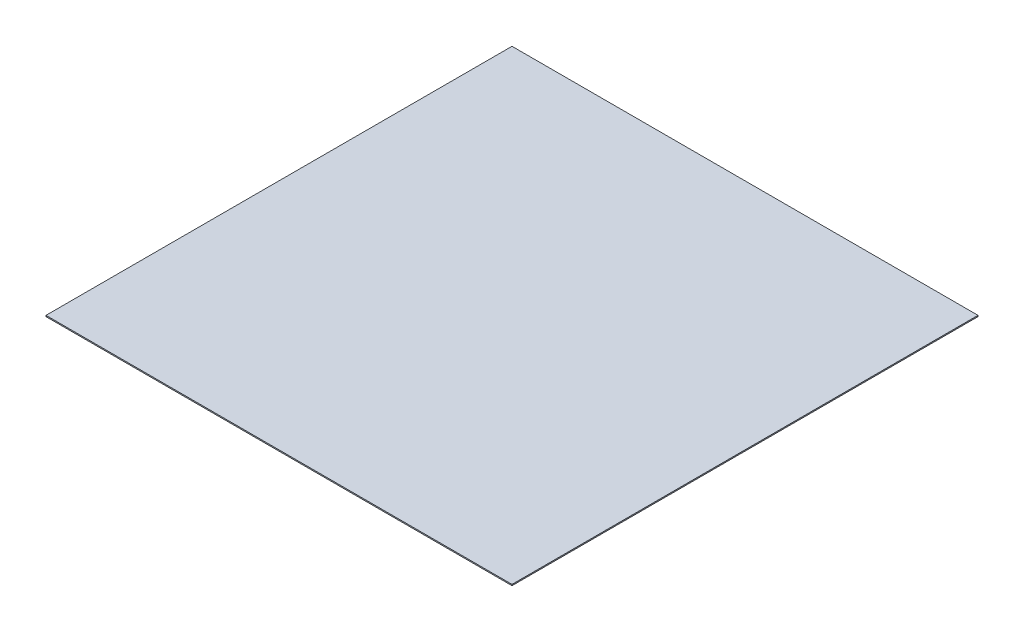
SolidWorks part; units mm, degrees
ref_plane "Plan de face" through (0, 0, 0) normal (0, 0, 1) x (1, 0, 0)
ref_plane "Plan de dessus" through (0, 0, 0) normal (0, 1, 0) x (1, 0, 0)
ref_plane "Plan de droite" through (0, 0, 0) normal (1, 0, 0) x (0, 0, -1)
sketch "Esquisse1" plane through (0, 0, 0) normal (0, 0, 1) x (1, 0, 0)
  line L0 (-1000, 0) -> (1000, 0)
  dimension "D1" = 2000
extrude "Extru.-Mince1" add sketch "Esquisse1" along normal mid plane 2000 thin
